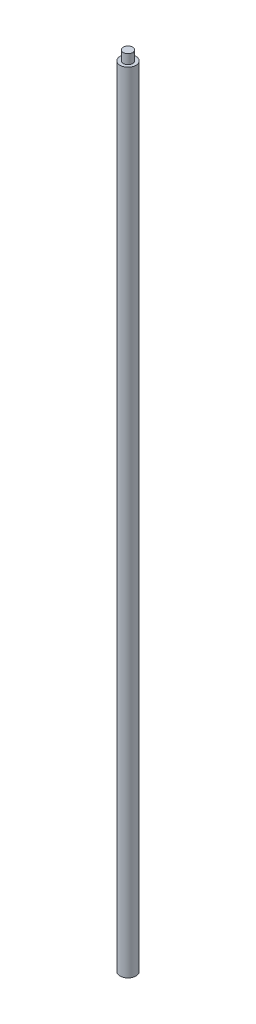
SolidWorks part; units mm, degrees
ref_plane "Front" through (0, 0, 0) normal (0, 0, 1) x (1, 0, 0)
ref_plane "Top" through (0, 0, 0) normal (0, 1, 0) x (1, 0, 0)
ref_plane "Right" through (0, 0, 0) normal (1, 0, 0) x (0, 0, -1)
sketch "Sketch1" plane through (0, 0, 0) normal (0, 1, 0) x (1, 0, 0)
  circle A0 centre (0, 0) radius 2.5
extrude "Extrude1" add sketch "Sketch1" along normal blind 250
sketch "Sketch2" plane through (0, 250, 0) normal (0, 1, 0) x (-1, 0, 0)
  circle A0 centre (0, 0) radius 1.5
extrude "Extrude2" add sketch "Sketch2" along normal blind 3
